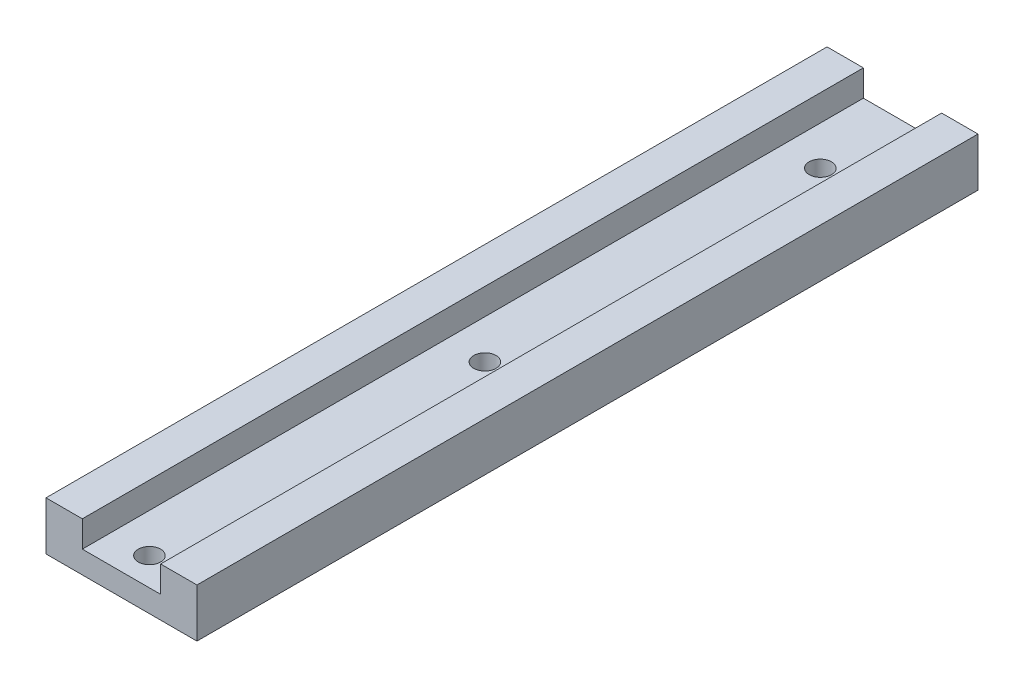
SolidWorks part; units mm, degrees
ref_plane "Front Plane" through (0, 0, 0) normal (0, 0, 1) x (1, 0, 0)
ref_plane "Top Plane" through (0, 0, 0) normal (0, 1, 0) x (1, 0, 0)
ref_plane "Right Plane" through (0, 0, 0) normal (1, 0, 0) x (0, 0, -1)
sketch "Sketch1" plane through (0, 0, 0) normal (0, 0, 1) x (1, 0, 0)
  line L0 (7, 4.35) -> (13.5, 4.35)
  line L1 (-13.5, -4.35) -> (13.5, -4.35)
  line L2 (-13.5, -4.35) -> (-13.5, 4.35)
  line L3 (-13.5, 4.35) -> (-7, 4.35)
  line L4 (13.5, -4.35) -> (13.5, 4.35)
  line L5 (-13.5, -4.35) -> (13.5, 4.35) construction
  line L6 (-13.5, 4.35) -> (13.5, -4.35) construction
  line L7 (0, -0.35) -> (0, -4.35) construction
  line L8 (-7, 4.35) -> (-7, -0.35)
  line L9 (-7, -0.35) -> (7, -0.35)
  line L10 (7, 4.35) -> (7, -0.35)
  point P0 (0, 0)
  dimension "D1" = 14
  dimension "D2" = 8.7
  dimension "D3" = 27
  dimension "D4" = 4
extrude "Boss-Extrude1" add sketch "Sketch1" along normal blind 139.7
sketch "Sketch2" plane through (0, -0.35, 0) normal (0, 1, 0) x (1, 0, 0)
  line L0 (0, -139.7) -> (0, -134.7) construction
  line L1 (7, -139.7) -> (-7, -139.7) construction
  circle A0 centre (0, -134.7) radius 2
  dimension "D1" = 4
  dimension "D2" = 5
extrude "Cut-Extrude1" cut sketch "Sketch2" against normal through all
pattern_linear "LPattern1" count 3 spacing 60 along (0, 0, -1) of "Cut-Extrude1"
